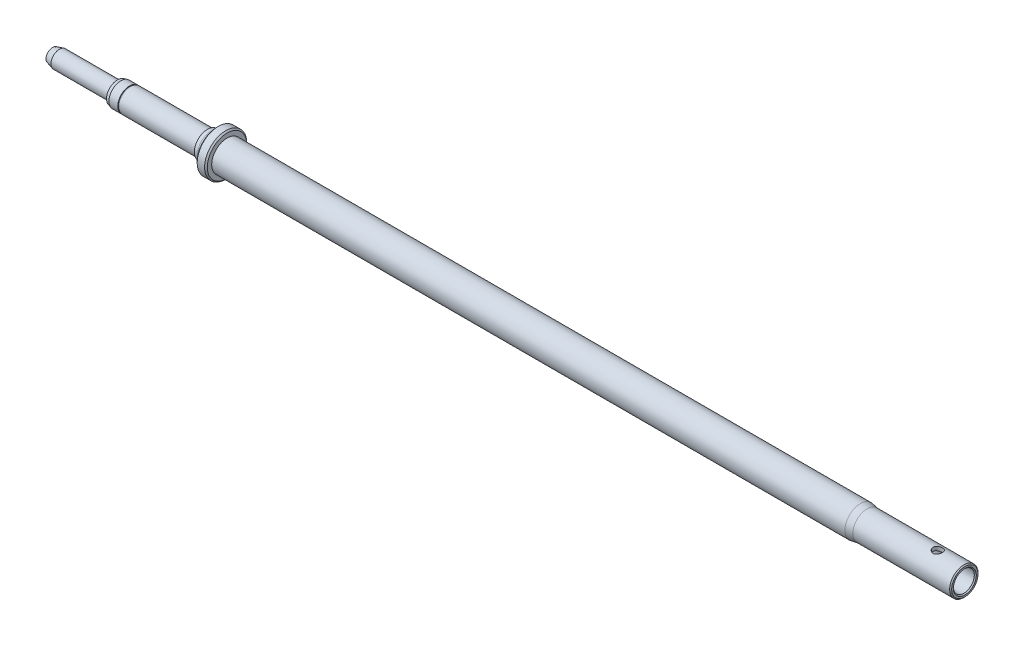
SolidWorks part; units mm, degrees
ref_plane "Plan de face" through (0, 0, 0) normal (0, 0, 1) x (1, 0, 0)
ref_plane "Plan de dessus" through (0, 0, 0) normal (0, 1, 0) x (1, 0, 0)
ref_plane "Plan de droite" through (0, 0, 0) normal (1, 0, 0) x (0, 0, -1)
sketch "Esquisse1" plane through (0, 0, 0) normal (1, 0, 0) x (0, 0, -1)
  circle A0 centre (0, 0) radius 22.75
  dimension "D1" = 45.5
extrude "Extrusion1" add sketch "Esquisse1" along normal blind 963.5
sketch "Esquisse5" plane through (963.5, 0, 0) normal (1, 0, 0) x (0, 0, -1)
  circle A0 centre (0, 0) radius 21
  dimension "D1" = 42
extrude "Extrusion3" add sketch "Esquisse5" along normal blind 145
chamfer "Chanfrein8" distance 1.5 angle 45 1 edges at (1108.5, 0, -21)
sketch "Esquisse16" plane through (0, 0, 0) normal (0, 0, 1) x (1, 0, 0)
  line L0 (893.7515, 0) -> (982.8088, 0) construction
  line L2 (963.5, -22.75) -> (963.5, 22.75) construction
  line L3 (963.5, 22.75) -> (0, 22.75) construction
  line L4 (963.5, 22.75) -> (953.5, 22.75)
  line L5 (963.5, 21) -> (953.5, 22.75)
  line L7 (963.5, 21) -> (963.5, 22.75)
  line L8 (1107, 21) -> (963.5, 21) construction
  dimension "D1" = 10
revolve "Enlèvement de matière-Révolution2" cut sketch "Esquisse16" angle 360 about L0
sketch "Esquisse7" plane through (1108.5, 0, 0) normal (1, 0, 0) x (0, 0, -1)
  circle A0 centre (0, 0) radius 15.5
  dimension "D1" = 31
extrude "Enlèv. mat.-Extru.1" cut sketch "Esquisse7" against normal blind 1018
sketch "Esquisse17" plane through (0, 0, 0) normal (0, 1, 0) x (1, 0, 0)
  line L0 (1108.5, -21) -> (1108.5, 21) construction
  circle A0 centre (1068.5, 0) radius 7
  dimension "D1" = 14
  dimension "D2" = 40
extrude "Enlèv. mat.-Extru.5" cut sketch "Esquisse17" along normal through all
chamfer "Chanfrein3" distance 1.5 angle 45 1 edges at (1108.5, 0, -15.5)
sketch "Esquisse8" plane through (0, 0, 0) normal (-1, 0, 0) x (0, 0, 1)
  circle A0 centre (0, 0) radius 31.25
  circle A1 centre (0, 0) radius 22.75 construction
  circle A2 centre (0, 0) radius 22.75
  dimension "D1" = 62.5
extrude "Extrusion4" add sketch "Esquisse8" against normal blind 15
chamfer "Chanfrein6" distance 2 angle 45 2 edges at (15, 0, 31.25) (0, 0, 31.25)
sketch "Esquisse18" plane through (0, 0, 0) normal (-1, 0, 0) x (0, 0, 1)
  circle A0 centre (0, 0) radius 19.5
  dimension "D1" = 39
extrude "Extrusion5" add sketch "Esquisse18" along normal blind 14
sketch "Esquisse19" plane through (-14, 0, 0) normal (-1, 0, 0) x (0, 0, 1)
  circle A0 centre (0, 0) radius 17.5
  dimension "D1" = 35
extrude "Extrusion6" add sketch "Esquisse19" along normal blind 93
sketch "Esquisse20" plane through (-107, 0, 0) normal (-1, 0, 0) x (0, 0, 1)
  circle A0 centre (0, 0) radius 17.5
  dimension "D1" = 35
extrude "Extrusion7" add sketch "Esquisse20" along normal blind 40.5
chamfer "Chanfrein10" distance 5 angle 15 1 edges at (-147.5, 0, 17.5)
sketch "Esquisse21" plane through (-147.5, 0, 0) normal (-1, 0, 0) x (0, 0, 1)
  circle A0 centre (0, 0) radius 12.5
  dimension "D1" = 25
extrude "Extrusion8" add sketch "Esquisse21" along normal blind 96
chamfer "Chanfrein9" distance 10 angle 15 1 edges at (-243.5, 0, 12.5)
fillet "Congé1" radius 9 1 edges at (0, 0, -19.5)
sketch "Esquisse23" plane through (-243.5, 0, 0) normal (-1, 0, 0) x (0, 0, 1)
  circle A0 centre (0, 0) radius 7
  dimension "D1" = 14
extrude "Enlèv. mat.-Extru.6" cut sketch "Esquisse23" against normal blind 102
sketch "Esquisse24" plane through (-141.5, 0, 0) normal (-1, 0, 0) x (0, 0, 1)
  circle A0 centre (0, 0) radius 7.75
  dimension "D1" = 15.5
extrude "Enlèv. mat.-Extru.7" cut sketch "Esquisse24" against normal blind 113
sketch "Esquisse25" plane through (-28.5, 0, 0) normal (-1, 0, 0) x (0, 0, 1)
  circle A0 centre (0, 0) radius 9.75
  dimension "D1" = 19.5
extrude "Enlèv. mat.-Extru.8" cut sketch "Esquisse25" against normal through all
sketch "Esquisse26" plane through (0, 0, 0) normal (0, 0, 1) x (1, 0, 0)
  line L0 (-14, 17.5) -> (-142.5, 17.5) construction
  line L1 (-129.5, 17.5) -> (-127.9, 17.5)
  line L2 (-129.5, 17.5) -> (-129.5, 16.5)
  line L3 (-129.5, 16.5) -> (-127.9, 16.5)
  line L4 (-127.9, 17.5) -> (-127.9, 16.5)
  line L5 (-136.2319, 0) -> (-106.72, 0) construction
  line L6 (-14, 19.5) -> (-14, -19.5) construction
  dimension "D1" = 115.5
  dimension "D2" = 1.6
  dimension "D3" = 33
revolve "Enlèvement de matière-Révolution3" cut sketch "Esquisse26" angle 360 about L5
